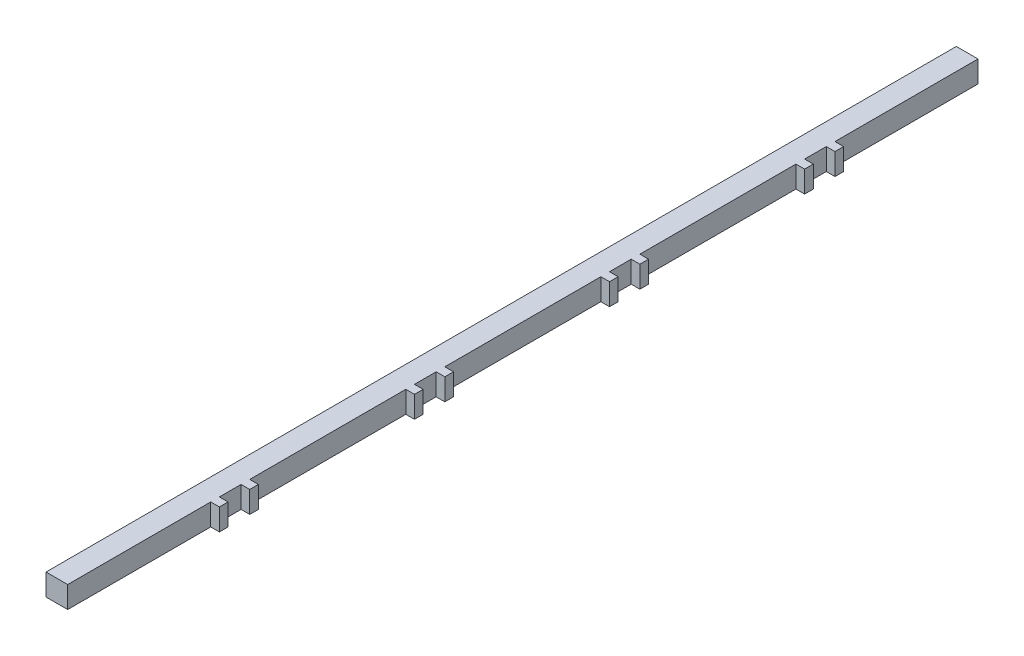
SolidWorks part; units mm, degrees
ref_plane "Front Plane" through (0, 0, 0) normal (0, 0, 1) x (1, 0, 0)
ref_plane "Top Plane" through (0, 0, 0) normal (0, 1, 0) x (1, 0, 0)
ref_plane "Right Plane" through (0, 0, 0) normal (1, 0, 0) x (0, 0, -1)
sketch "Sketch1" plane through (0, 0, 0) normal (0, 0, 1) x (1, 0, 0)
  line L0 (-6.35, 6.35) -> (0, 6.35)
  line L1 (0, 6.35) -> (0, 0)
  line L2 (0, 0) -> (-6.35, 0)
  line L3 (-6.35, 6.35) -> (-6.35, 0)
  dimension "D1" = 6.35
  dimension "D2" = 6.35
extrude "Boss-Extrude1" add sketch "Sketch1" along normal blind 279.4
sketch "Sketch2" plane through (0, 0, 0) normal (1, 0, 0) x (0, 0, -1)
  line L0 (-279.4, 6.35) -> (0, 6.35) construction
  line L1 (-231.14, 0) -> (-228.6, 0)
  line L2 (-231.14, 0) -> (-231.14, 6.35)
  line L3 (-231.14, 6.35) -> (-228.6, 6.35)
  line L4 (-228.6, 0) -> (-228.6, 6.35)
  line L6 (-279.4, 0) -> (0, 0) construction
  line L7 (-173.99, 0) -> (-173.99, 6.35)
  line L8 (-222.25, 6.35) -> (-219.71, 6.35)
  line L9 (-222.25, 6.35) -> (-222.25, 0)
  line L10 (-222.25, 0) -> (-219.71, 0)
  line L11 (-219.71, 6.35) -> (-219.71, 0)
  line L12 (-173.99, 0) -> (-171.45, 0)
  line L13 (-171.45, 0) -> (-171.45, 6.35)
  line L14 (-173.99, 6.35) -> (-171.45, 6.35)
  line L15 (-165.1, 6.35) -> (-165.1, 0)
  line L16 (-165.1, 6.35) -> (-162.56, 6.35)
  line L17 (-162.56, 6.35) -> (-162.56, 0)
  line L18 (-165.1, 0) -> (-162.56, 0)
  line L19 (-116.84, 0) -> (-116.84, 6.35)
  line L20 (-116.84, 0) -> (-114.3, 0)
  line L21 (-114.3, 0) -> (-114.3, 6.35)
  line L22 (-116.84, 6.35) -> (-114.3, 6.35)
  line L23 (-107.95, 6.35) -> (-107.95, 0)
  line L24 (-107.95, 6.35) -> (-105.41, 6.35)
  line L25 (-105.41, 6.35) -> (-105.41, 0)
  line L26 (-107.95, 0) -> (-105.41, 0)
  line L27 (-59.69, 0) -> (-59.69, 6.35)
  line L28 (-59.69, 0) -> (-57.15, 0)
  line L29 (-57.15, 0) -> (-57.15, 6.35)
  line L30 (-59.69, 6.35) -> (-57.15, 6.35)
  line L31 (-50.8, 6.35) -> (-50.8, 0)
  line L32 (-50.8, 6.35) -> (-48.26, 6.35)
  line L33 (-48.26, 6.35) -> (-48.26, 0)
  line L34 (-50.8, 0) -> (-48.26, 0)
  line L35 (-279.4, 0) -> (-279.4, 6.35) construction
  dimension "D1" = 50.8
  dimension "D2" = 2.54
  dimension "D3" = 6.35
  dimension "D5" = 50.8
  dimension "D4" = 4
extrude "Boss-Extrude2" add sketch "Sketch2" along normal blind 2.54 contours L2 L3 L4 L1 | L9 L8 L11 L10 | L7 L14 L13 L12 | L15 L18 L17 L16 | L19 L22 L21 L20 | L23 L26 L25 L24 | L27 L30 L29 L28 | L31 L34 L33 L32
sketch "Sketch3" plane through (0, 6.35, 0) normal (0, 1, 0) x (1, 0, 0)
  line L0 (0, 0) -> (-6.35, 0) construction
  line L1 (-6.35, -279.4) -> (0, -279.4)
  line L2 (-6.35, -279.4) -> (-6.35, -273.05)
  line L3 (-6.35, -273.05) -> (0, -273.05)
  line L4 (0, -279.4) -> (0, -273.05)
  line L5 (-6.35, 0) -> (0, 0)
  line L6 (-6.35, 0) -> (-6.35, -6.35)
  line L7 (-6.35, -6.35) -> (0, -6.35)
  line L8 (0, 0) -> (0, -6.35)
  line L9 (0, -279.4) -> (-6.35, -279.4) construction
  line L10 (0, -279.4) -> (0, -231.14) construction
  line L12 (-6.35, -279.4) -> (-6.35, 0) construction
  line L13 (0, -48.26) -> (0, 0) construction
  dimension "D1" = 6.35
  dimension "D2" = 6.35
extrude "Cut-Extrude1" cut sketch "Sketch3" against normal through all
